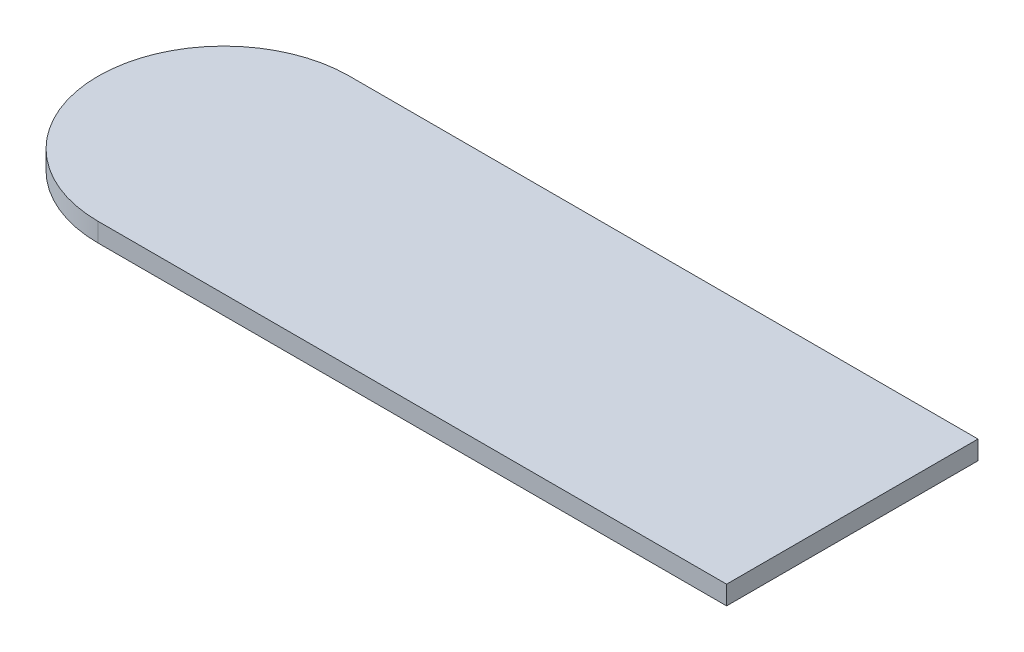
SolidWorks part; units mm, degrees
ref_plane "Plan de face" through (0, 0, 0) normal (0, 0, 1) x (1, 0, 0)
ref_plane "Plan de dessus" through (0, 0, 0) normal (0, 1, 0) x (1, 0, 0)
ref_plane "Plan de droite" through (0, 0, 0) normal (1, 0, 0) x (0, 0, -1)
sketch "Esquisse1" plane through (0, 0, 0) normal (0, 0, 1) x (1, 0, 0)
  line L0 (0, 0) -> (-120, 0)
  dimension "D1" = 120
sheet metal parameters "Tôlerie 1" thickness 3 parameters "D1"=4
base flange "Tôle de base pliée1" sketch "Esquisse1" end condition mid plane depth 40 reverse direction no thickness 3 reverse thickness direction no bend radius 4
fillet "Congé2" radius 20 2 edges at (-120, 1.5, -20) (-120, 1.5, 20)
flat pattern "Etat déplié1"
sketch "Lignes de pliage1" plane through (0, 0, 0) normal (0, 1, 0) x (1, 0, 0)
sketch3d "Cube de visualisation1" [suppressed]
  line L0 (120, 40, 0) -> (0, 40, 0) construction
  line L1 (120, 0, 0) -> (0, 0, 0) construction
  line L2 (120, 40, 0) -> (120, 0, 0) construction
  line L3 (0, 40, 0) -> (0, 0, 0) construction
